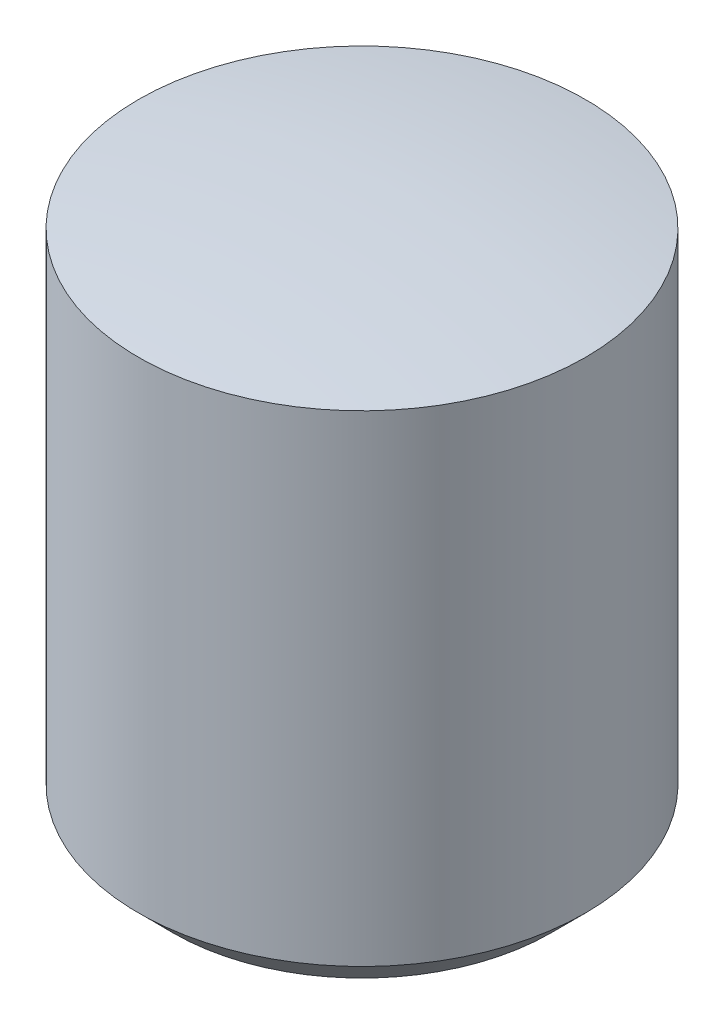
SolidWorks part; units mm, degrees
ref_plane "Plan de face" through (0, 0, 0) normal (0, 0, 1) x (1, 0, 0)
ref_plane "Plan de dessus" through (0, 0, 0) normal (0, 1, 0) x (1, 0, 0)
ref_plane "Plan de droite" through (0, 0, 0) normal (1, 0, 0) x (0, 0, -1)
sketch "Esquisse2" plane through (0, 0, 0) normal (0, 0, 1) x (1, 0, 0)
  line L0 (0, 0) -> (0, 15.5)
  line L1 (0, 0) -> (0, 22.9502) construction
  line L4 (0, 0) -> (-6.5, 0)
  line L5 (-6.5, 15) -> (-6.5, 0)
  arc A0 (6.5, 15) -> (-6.5, 15) centre (0, -27) ccw construction
  arc A1 (0, 15.5) -> (-6.5, 15) centre (0, -27) ccw
revolve "Révolution1" add sketch "Esquisse2" angle 360 about L0
hole_wizard "Trou taraudé M61" positions "Esquisse3" profile "Esquisse4" tap size "M6" standard "ISO"
sketch "Esquisse3" plane through (0, 0, 0) normal (0, -1, 0) x (1, 0, 0)
  point P0 (0, 0)
sketch "Esquisse4" plane through (0, 0, 0) normal (1, 0, 0) x (0, 0, -1)
  line L0 (0, 0) -> (0, 13.5022)
  line L1 (0, 13.5022) -> (2.5, 12)
  line L2 (2.5, 12) -> (2.5, 0)
  line L5 (2.5, 0) -> (0, 0)
  line L10 (0, 13.5022) -> (-2.5, 12) construction
  line L11 (0, -6.35) -> (0, 107.95) construction
  dimension "Diamètre du trou pour taraudage" = 5
  dimension "Profondeur du trou pour taraudage" = 12
  dimension "Angle de pointe" = 118
chamfer "Chanfrein1" distance 1 angle 45 1 edges at (6.5, 0, 0)
